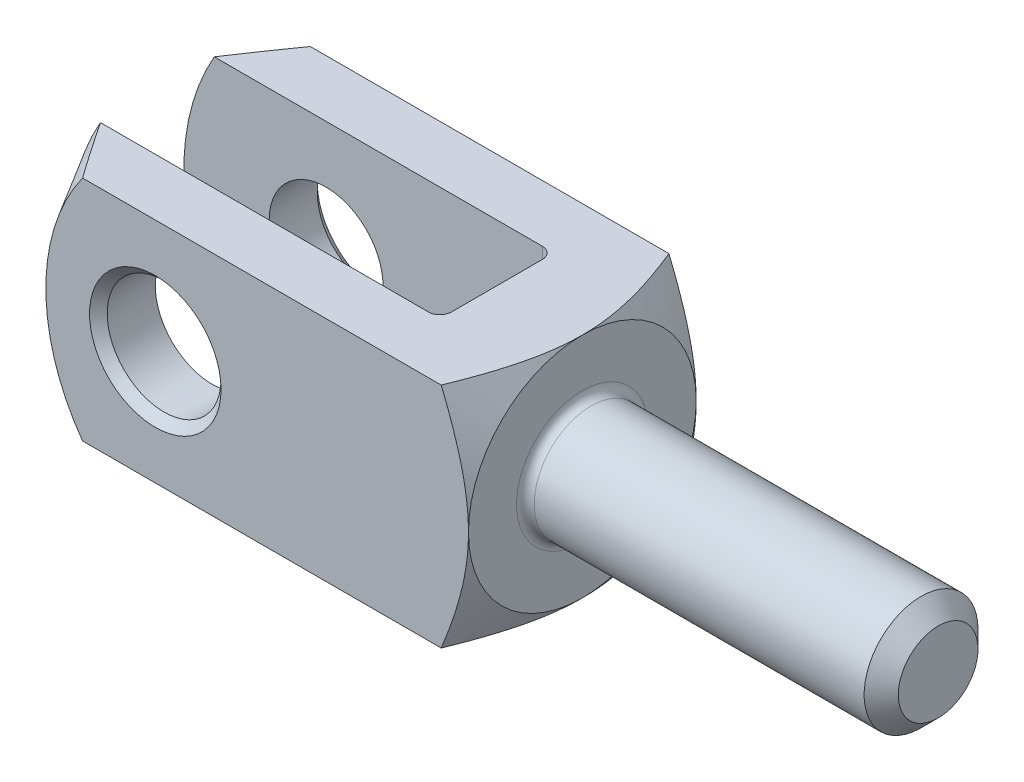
SolidWorks part; units mm, degrees
ref_plane "Front Plane" through (0, 0, 0) normal (0, 0, 1) x (1, 0, 0)
ref_plane "Top Plane" through (0, 0, 0) normal (0, 1, 0) x (1, 0, 0)
ref_plane "Right Plane" through (0, 0, 0) normal (1, 0, 0) x (0, 0, -1)
sketch "Sketch1" plane through (0, 0, 0) normal (1, 0, 0) x (0, 0, -1)
  line L0 (0, 0) -> (0, 50000) construction
  line L1 (0, 0) -> (50000, 0) construction
  line L2 (-8, -8) -> (-8, 8)
  line L3 (-8, 8) -> (8, 8)
  line L4 (8, -8) -> (8, 8)
  line L5 (-8, -8) -> (8, -8)
  point P9 (0, 8)
  point P11 (8, 0)
  point P12 (-8, 0)
  dimension "D1" = 16
  dimension "D2" = 16
extrude "Extrude1" add sketch "Sketch1" against normal blind 57
sketch "Sketch2" plane through (0, 0, 0) normal (1, 0, 0) x (0, 0, -1)
  circle A0 centre (0, 0) radius 4
  circle A1 centre (0, 0) radius 16
  dimension "D1" = 8
  dimension "D2" = 32
extrude "Extrude2" cut sketch "Sketch2" against normal blind 25
sketch "Sketch3" plane through (0, 0, 8) normal (0, 0, 1) x (1, 0, 0)
  circle A0 centre (-47, 0) radius 4
  dimension "D1" = 8
  dimension "D2" = 47
extrude "Extrude3" cut sketch "Sketch3" against normal through all
sketch "Sketch4" plane through (0, 8, 0) normal (0, 1, 0) x (1, 0, 0)
  line L0 (0, 0) -> (-50000, 0) construction
  line L1 (-57, -4) -> (-57, 4)
  line L2 (-57, 8) -> (-57, -8) construction
  line L3 (-57, 4) -> (-31, 4)
  line L4 (-31, 4) -> (-31, -4)
  line L5 (-47, 8) -> (-47, -8) construction
  line L6 (-57, -4) -> (-31, -4)
  point P7 (-47, 0)
  point P13 (-31, 0)
  point P14 (-57, 0)
  dimension "D1" = 16
  dimension "D2" = 8
extrude "Extrude4" cut sketch "Sketch4" against normal through all
fillet "Fillet1" radius 0.8 2 edges at (-31, 0, 4) (-31, 0, -4)
fillet "Fillet2" radius 0.62 1 edges at (-25, 0, -4)
chamfer "Chamfer2" distance 0.62 angle 45 2 edges at (-43, 0, -8) (-43, 0, 8)
sketch "Sketch6" plane through (0, 0, 0) normal (0, 0, 1) x (1, 0, 0)
  line L0 (-25, -8) -> (-25, -16)
  line L1 (-25, -16) -> (-29.6188, -16)
  line L2 (-29.6188, -16) -> (-25, -8)
  dimension "D1" = 30
  dimension "D2" = 16
revolve "Cut-Revolve1" cut sketch "Sketch6" angle 360 about axis through (-25, 0, 0) along (1, 0, 0)
sketch "Sketch7" plane through (0, 0, 0) normal (0, 1, 0) x (1, 0, 0)
  line L0 (-54.6906, -8) -> (-57, -4)
  line L1 (-57, 4) -> (-54.6906, 8)
  line L2 (-54.6906, 8) -> (-73, 8)
  line L3 (-57, 4) -> (-57, -4)
  line L4 (-73, 8) -> (-73, -8)
  line L5 (-73, -8) -> (-54.6906, -8)
  line L6 (-57, 8) -> (-26.9132, 8) construction
  line L7 (-57, -8) -> (-26.9132, -8) construction
  line L8 (-41, 0.6162) -> (-41, 50000.6162) construction
  dimension "D1" = 120
  dimension "D2" = 16
  dimension "D3" = 16
revolve "Cut-Revolve2" cut sketch "Sketch7" angle 180 about L8
chamfer "Chamfer3" distance 1.2 angle 45 1 edges at (0, 0, -4)
equation "\"D2@Sketch1\" = \"D1@Sketch1\""
equation "\"D2@Sketch2\" = \"D1@Sketch1\"/.5"
equation "\"D2@Sketch6\" = \"D1@Sketch1\""
equation "\"D2@Sketch7\" = \"D1@Sketch1\""
equation "\"D3@Sketch7\" = \"D1@Sketch1\""
